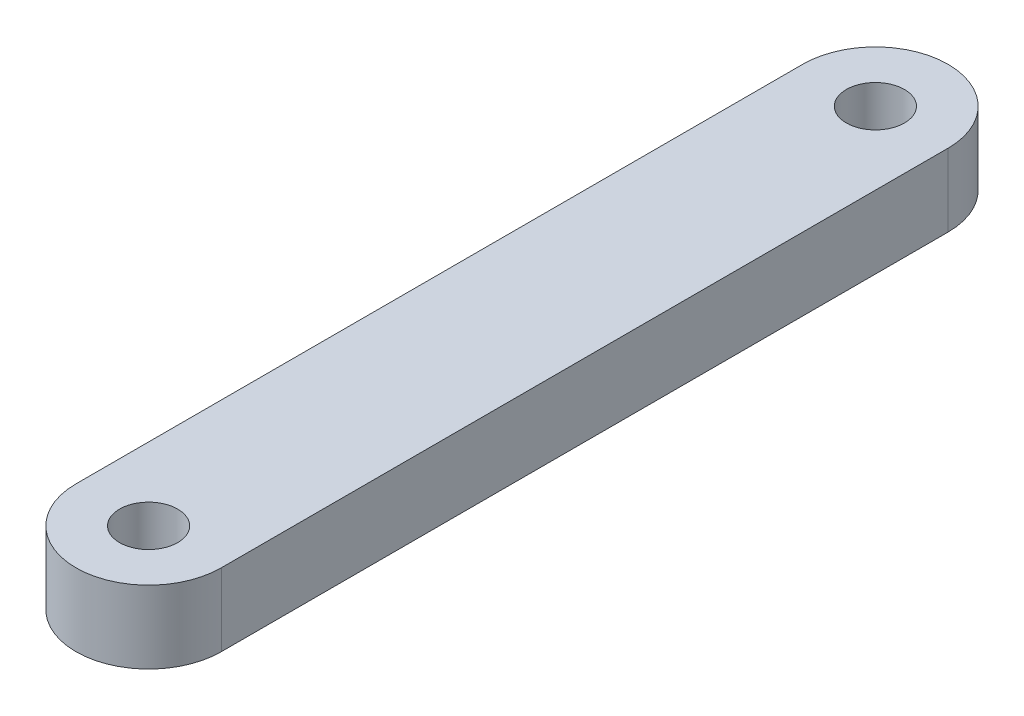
SolidWorks part; units mm, degrees
ref_plane "Front Plane" through (0, 0, 0) normal (0, 0, 1) x (1, 0, 0)
ref_plane "Top Plane" through (0, 0, 0) normal (0, 1, 0) x (1, 0, 0)
ref_plane "Right Plane" through (0, 0, 0) normal (1, 0, 0) x (0, 0, -1)
sketch "Sketch1" plane through (0, 0, 0) normal (0, 1, 0) x (1, 0, 0)
  line L0 (0, -25) -> (0, 25) construction
  line L1 (5, -25) -> (5, 25)
  line L2 (-5, -25) -> (-5, 25)
  circle A0 centre (0, 25) radius 2
  circle A1 centre (0, -25) radius 2
  arc A2 (5, -25) -> (-5, -25) centre (0, -25) cw
  arc A3 (5, 25) -> (-5, 25) centre (0, 25) ccw
  point P4 (0, 0)
  dimension "D2" = 4
  dimension "D1" = 50
  dimension "D3" = 5
  dimension "D4" = 5
extrude "Boss-Extrude1" add sketch "Sketch1" along normal blind 5
